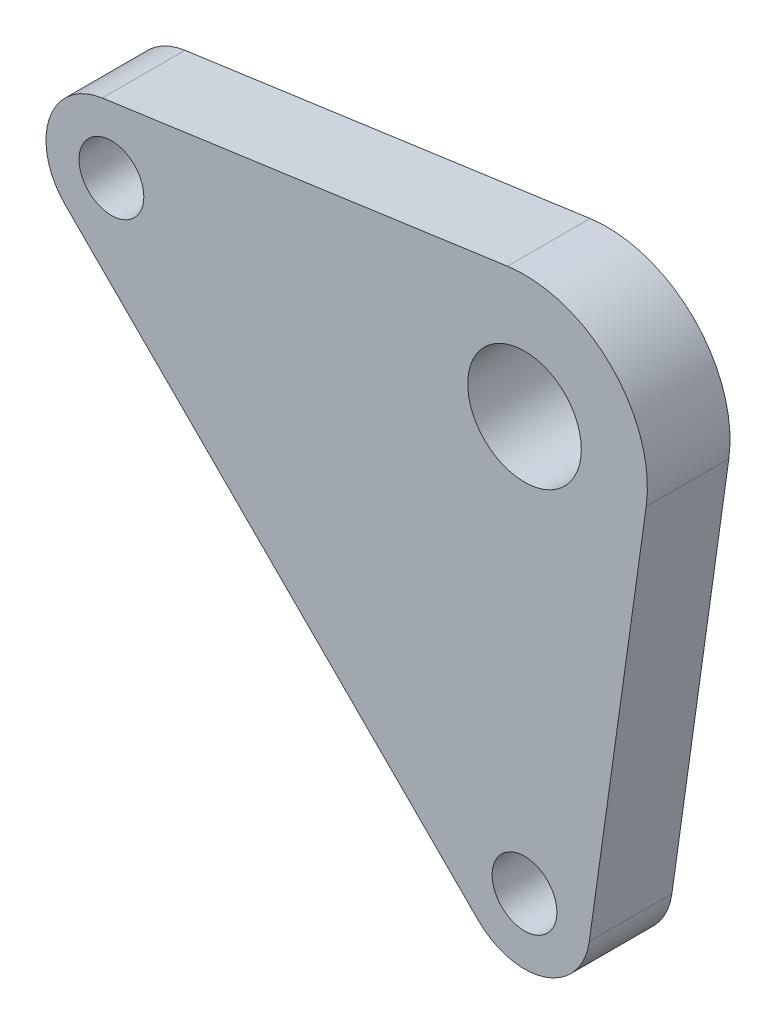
SolidWorks part; units mm, degrees
ref_plane "Front Plane" through (0, 0, 0) normal (0, 0, 1) x (1, 0, 0)
ref_plane "Top Plane" through (0, 0, 0) normal (0, 1, 0) x (1, 0, 0)
ref_plane "Right Plane" through (0, 0, 0) normal (1, 0, 0) x (0, 0, -1)
sketch "Sketch1" plane through (0, 0, 0) normal (0, 0, 1) x (1, 0, 0)
  line L0 (-18.4277, 0) -> (18.4277, 0) construction
  line L1 (0, 0) -> (0, -18.4277) construction
  line L2 (-18.4277, 0) -> (-31.75, 0) construction
  line L3 (0, -18.4277) -> (0, -31.75) construction
  line L4 (-36.6378, -1.1843) -> (-46.1737, 38.1707) construction
  line L5 (-43.0401, 44.1279) -> (-23.6409, 51.5318) construction
  line L6 (-14.3575, 51.5318) -> (5.0417, 44.1279) construction
  line L7 (-3.5562, -35.3062) -> (-35.3062, -3.5562)
  line L8 (-18.9992, 39.37) -> (-5.334, 39.37) construction
  line L9 (-5.334, 39.37) -> (3.2258, 39.37) construction
  line L10 (-18.9992, 39.37) -> (-32.6644, 39.37) construction
  line L11 (-32.6644, 39.37) -> (-41.2242, 39.37) construction
  line L13 (7.9994, 41.1442) -> (22.7014, 1.5884) construction
  line L14 (-32.4496, 4.9803) -> (-1.3139, 9.3538)
  line L15 (9.3538, -1.3139) -> (4.9803, -32.4496)
  circle A0 centre (0, 0) radius 4.3656
  circle A2 centre (-18.4277, 0) radius 2.0193 construction
  circle A3 centre (0, -18.4277) radius 2.0193 construction
  circle A4 centre (-31.75, 0) radius 2.4892
  circle A5 centre (0, -31.75) radius 2.4892
  circle A6 centre (0, 0) radius 9.4456 construction
  circle A7 centre (-31.75, 0) radius 5.0292 construction
  circle A8 centre (0, -31.75) radius 5.0292 construction
  arc A10 (-36.6378, -1.1843) -> (-35.3062, -3.5562) centre (-31.75, 0) ccw
  arc A11 (-3.5562, -35.3062) -> (4.9803, -32.4496) centre (0, -31.75) ccw
  circle A12 centre (-18.9992, 39.37) radius 13.0175 construction
  circle A13 centre (-41.2242, 39.37) radius 5.0927 construction
  circle A14 centre (-18.9992, 39.37) radius 7.9375 construction
  circle A15 centre (-18.9992, 39.37) radius 11.1125 construction
  circle A16 centre (-5.334, 39.37) radius 2.5527 construction
  circle A17 centre (-32.6644, 39.37) radius 2.5527 construction
  circle A18 centre (-41.2242, 39.37) radius 2.5527 construction
  circle A19 centre (3.2258, 39.37) radius 2.5527 construction
  circle A20 centre (-5.334, 39.37) radius 2.0193 construction
  circle A21 centre (-32.6644, 39.37) radius 2.0193 construction
  circle A22 centre (3.2258, 39.37) radius 5.0927 construction
  arc A24 (7.9994, 41.1442) -> (5.0417, 44.1279) centre (3.2258, 39.37) ccw construction
  arc A25 (-14.3575, 51.5318) -> (-23.6409, 51.5318) centre (-18.9992, 39.37) ccw construction
  arc A26 (-43.0401, 44.1279) -> (-46.1737, 38.1707) centre (-41.2242, 39.37) ccw construction
  arc A29 (9.3538, -1.3139) -> (-1.3139, 9.3538) centre (0, 0) ccw
  arc A30 (-32.4496, 4.9803) -> (-36.6378, -1.1843) centre (-31.75, 0) ccw
  dimension "D3" = 8.7312
  dimension "D4" = 4.0386
  dimension "D5" = 4.9784
  dimension "D7" = 5.08
  dimension "D11" = 15.875
  dimension "D12" = 22.225
  dimension "D13" = 5.1054
  dimension "D14" = 4.0386
  dimension "D16" = 5.1054
  dimension "D2" = 18.4277
  dimension "D6" = 31.75
  dimension "D15" = 22.225
  dimension "D17" = 39.37
  dimension "D20" = 3.2258
  dimension "D10" = 31.75
  dimension "D8" = 2.54
  dimension "D9" = 2.54
  dimension "D18" = 5.08
  dimension "D19" = 2.54
extrude "Boss-Extrude1" add sketch "Sketch1" along normal blind 6.35
